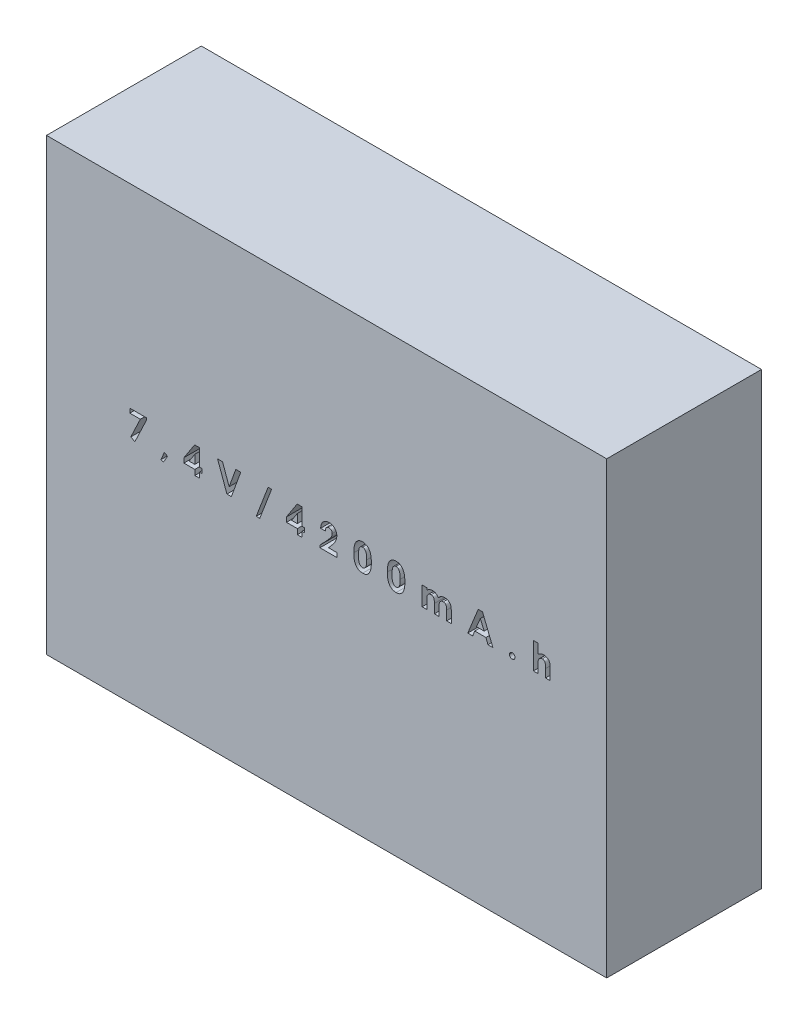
SolidWorks part; units mm, degrees
ref_plane "Plan de face" through (0, 0, 0) normal (0, 0, 1) x (1, 0, 0)
ref_plane "Plan de dessus" through (0, 0, 0) normal (0, 1, 0) x (1, 0, 0)
ref_plane "Plan de droite" through (0, 0, 0) normal (1, 0, 0) x (0, 0, -1)
sketch "Esquisse1" plane through (0, 0, 0) normal (0, 0, 1) x (1, 0, 0)
  line L1 (-30.3789, 16.3672) -> (45.6211, 16.3672)
  line L2 (-30.3789, 16.3672) -> (-30.3789, -44.6328)
  line L3 (-30.3789, -44.6328) -> (45.6211, -44.6328)
  line L4 (45.6211, 16.3672) -> (45.6211, -44.6328)
  dimension "D1" = 76
  dimension "D2" = 61
extrude "Boss.-Extru.1" add sketch "Esquisse1" along normal blind 21
sketch "Esquisse2" plane through (0, 0, 21) normal (0, 0, 1) x (1, 0, 0)
  line L0 (38.3132, -13.5347) -> (-19.354, -13.5347) construction
  text T0 "<b>7,4V/4200mA.h</b>"
extrude "Boss.-Extru.2" add sketch "Esquisse2" along normal blind 7.1578
